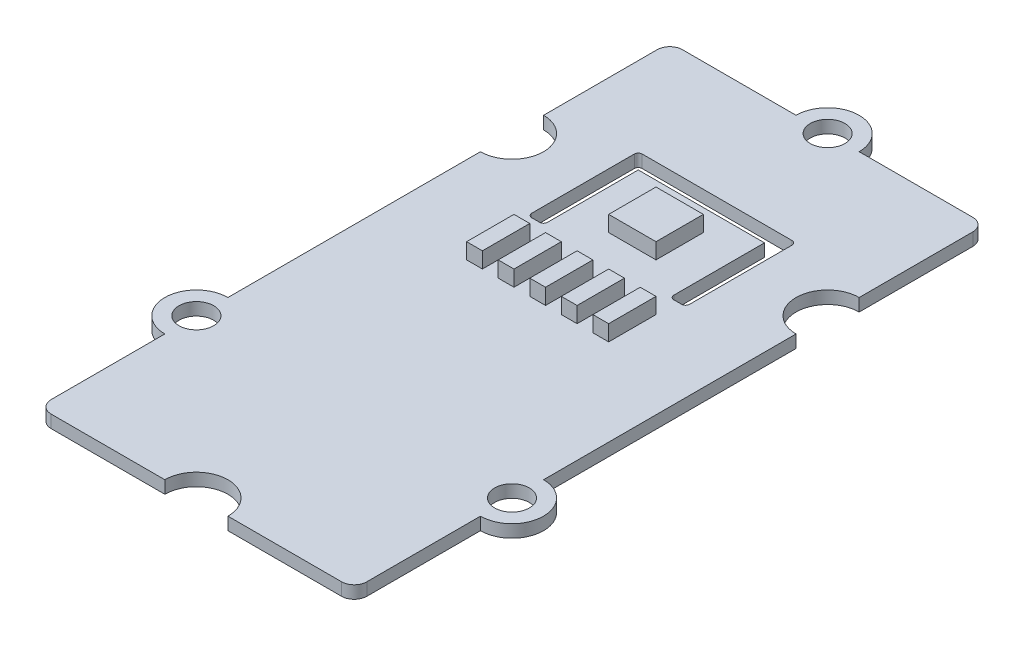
SolidWorks part; units mm, degrees
ref_plane "Front Plane" through (0, 0, 0) normal (0, 0, 1) x (1, 0, 0)
ref_plane "Top Plane" through (0, 0, 0) normal (0, 1, 0) x (1, 0, 0)
ref_plane "Right Plane" through (0, 0, 0) normal (1, 0, 0) x (0, 0, -1)
sketch "Sketch1" plane through (0, 0, 0) normal (0, 1, 0) x (1, 0, 0)
  line L0 (10, 0) -> (10, 40) construction
  line L1 (0.8, 0) -> (8, 0)
  line L2 (0, 0.8) -> (0, 8)
  line L3 (0.8, 40) -> (8, 40)
  line L4 (20, 0.8) -> (20, 8)
  line L5 (12, 40) -> (19.2, 40)
  line L6 (0, 32) -> (0, 39.2)
  line L7 (20, 32) -> (20, 39.2)
  line L8 (0, 12) -> (0, 28)
  line L9 (20, 12) -> (20, 28)
  line L10 (12, 0) -> (19.2, 0)
  arc A0 (0.8, 0) -> (0, 0.8) centre (0.8, 0.8) cw
  arc A1 (19.2, 0) -> (20, 0.8) centre (19.2, 0.8) ccw
  arc A2 (19.2, 40) -> (20, 39.2) centre (19.2, 39.2) cw
  arc A3 (0, 39.2) -> (0.8, 40) centre (0.8, 39.2) cw
  arc A4 (12, 40) -> (8, 40) centre (10, 40) ccw
  circle A5 centre (10, 40) radius 1.1
  arc A6 (0, 28) -> (0, 32) centre (0, 30) ccw
  arc A7 (20, 32) -> (20, 28) centre (20, 30) ccw
  arc A8 (0, 12) -> (0, 8) centre (0, 10) ccw
  arc A9 (20, 8) -> (20, 12) centre (20, 10) ccw
  arc A10 (12, 0) -> (8, 0) centre (10, 0) ccw
  circle A11 centre (0, 10) radius 1.1
  circle A12 centre (20, 10) radius 1.1
  point P7 (0, 0)
  point P10 (20, 0)
  point P13 (20, 40)
  dimension "D3" = 0.8
  dimension "D4" = 2
  dimension "D5" = 2.2
  dimension "D1" = 20
  dimension "D2" = 40
  dimension "D6" = 10
  dimension "D7" = 30
  dimension "D8" = 30
extrude "Board" add sketch "Sketch1" along normal blind 0.8
sketch "Sketch2" plane through (0, 0.8, 0) normal (0, 1, 0) x (1, 0, 0)
  line L0 (14.25, 26) -> (14.75, 26)
  line L1 (5.25, 33) -> (14.75, 33)
  line L2 (5, 32.75) -> (5, 26.25)
  line L3 (5.25, 26) -> (5.75, 26)
  line L4 (15, 32.75) -> (15, 26.25)
  line L6 (6, 26.25) -> (6, 32)
  line L7 (6, 32) -> (14, 32)
  line L8 (14, 26.25) -> (14, 32)
  line L9 (8, 40) -> (0.8, 40) construction
  arc A0 (12, 40) -> (8, 40) centre (10, 40) ccw construction
  arc A1 (5, 26.25) -> (5.25, 26) centre (5.25, 26.25) ccw
  arc A2 (5.75, 26) -> (6, 26.25) centre (5.75, 26.25) ccw
  arc A3 (14.75, 26) -> (15, 26.25) centre (14.75, 26.25) ccw
  arc A4 (14.25, 26) -> (14, 26.25) centre (14.25, 26.25) cw
  arc A5 (14.75, 33) -> (15, 32.75) centre (14.75, 32.75) cw
  arc A6 (5.25, 33) -> (5, 32.75) centre (5.25, 32.75) ccw
  point P8 (10, 32)
  point P9 (10, 33)
  point P10 (5.6543, 32.7865)
  point P14 (10, 42)
  point P19 (5, 26)
  point P22 (6, 26)
  point P25 (15, 26)
  point P30 (15, 33)
  point P33 (5, 33)
  dimension "D6" = 0.25
  dimension "D1" = 1
  dimension "D2" = 1
  dimension "D3" = 7
  dimension "D4" = 10
  dimension "D5" = 7
extrude "U-cut" cut sketch "Sketch2" against normal through all both and the other way through all
sketch "Sketch3" plane through (0, 0.8, 0) normal (0, 1, 0) x (1, 0, 0)
  line L0 (14, 32) -> (6, 32) construction
  line L1 (8.5, 30.625) -> (11.5, 30.625)
  line L2 (8.5, 30.625) -> (8.5, 27.625)
  line L3 (8.5, 27.625) -> (11.5, 27.625)
  line L4 (11.5, 30.625) -> (11.5, 27.625)
  line L5 (9.5, 24.625) -> (10.5, 24.625)
  line L6 (9.5, 24.625) -> (9.5, 21.625)
  line L7 (9.5, 21.625) -> (10.5, 21.625)
  line L8 (10.5, 24.625) -> (10.5, 21.625)
  line L9 (6, 32) -> (6, 26.25) construction
  line L10 (11.5, 24.625) -> (11.5, 21.625)
  line L11 (11.5, 24.625) -> (12.5, 24.625)
  line L12 (12.5, 24.625) -> (12.5, 21.625)
  line L13 (11.5, 21.625) -> (12.5, 21.625)
  line L14 (13.5, 24.625) -> (13.5, 21.625)
  line L15 (13.5, 24.625) -> (14.5, 24.625)
  line L16 (14.5, 24.625) -> (14.5, 21.625)
  line L17 (13.5, 21.625) -> (14.5, 21.625)
  line L18 (9.5, 24.625) -> (9.5, 21.625)
  line L19 (9.5, 24.625) -> (10.5, 24.625)
  line L20 (10.5, 24.625) -> (10.5, 21.625)
  line L21 (9.5, 21.625) -> (10.5, 21.625)
  line L22 (11.5, 24.625) -> (11.5, 21.625)
  line L23 (11.5, 24.625) -> (12.5, 24.625)
  line L24 (12.5, 24.625) -> (12.5, 21.625)
  line L25 (11.5, 21.625) -> (12.5, 21.625)
  line L26 (7.5, 24.625) -> (7.5, 21.625)
  line L27 (7.5, 24.625) -> (8.5, 24.625)
  line L28 (8.5, 24.625) -> (8.5, 21.625)
  line L29 (7.5, 21.625) -> (8.5, 21.625)
  line L30 (9.5, 24.625) -> (9.5, 21.625)
  line L31 (9.5, 24.625) -> (10.5, 24.625)
  line L32 (10.5, 24.625) -> (10.5, 21.625)
  line L33 (9.5, 21.625) -> (10.5, 21.625)
  line L34 (7.5, 24.625) -> (7.5, 21.625)
  line L35 (7.5, 24.625) -> (8.5, 24.625)
  line L36 (8.5, 24.625) -> (8.5, 21.625)
  line L37 (7.5, 21.625) -> (8.5, 21.625)
  line L38 (5.5, 24.625) -> (5.5, 21.625)
  line L39 (5.5, 24.625) -> (6.5, 24.625)
  line L40 (6.5, 24.625) -> (6.5, 21.625)
  line L41 (5.5, 21.625) -> (6.5, 21.625)
  line L42 (9.5, 24.625) -> (11.5, 24.625) construction
  line L43 (9.5, 24.625) -> (7.5, 24.625) construction
  point P10 (10, 32)
  point P11 (10, 30.625)
  point P12 (10, 24.625)
  point P13 (8.5, 29.125)
  point P16 (6, 29.125)
  dimension "D1" = 3
  dimension "D2" = 3
  dimension "D3" = 1
  dimension "D4" = 3
  dimension "D5" = 3
  dimension "D8" = 2
  dimension "D9" = 2
  dimension "D6" = 3
  dimension "D7" = 3
extrude "SMDs" add sketch "Sketch3" along normal blind 1 contours L38 L41 L40 L39 | L26 L29 L28 L27 | L8 L5 L6 L7 | L10 L13 L12 L11 | L14 L17 L16 L15 | L4 L1 L2 L3
